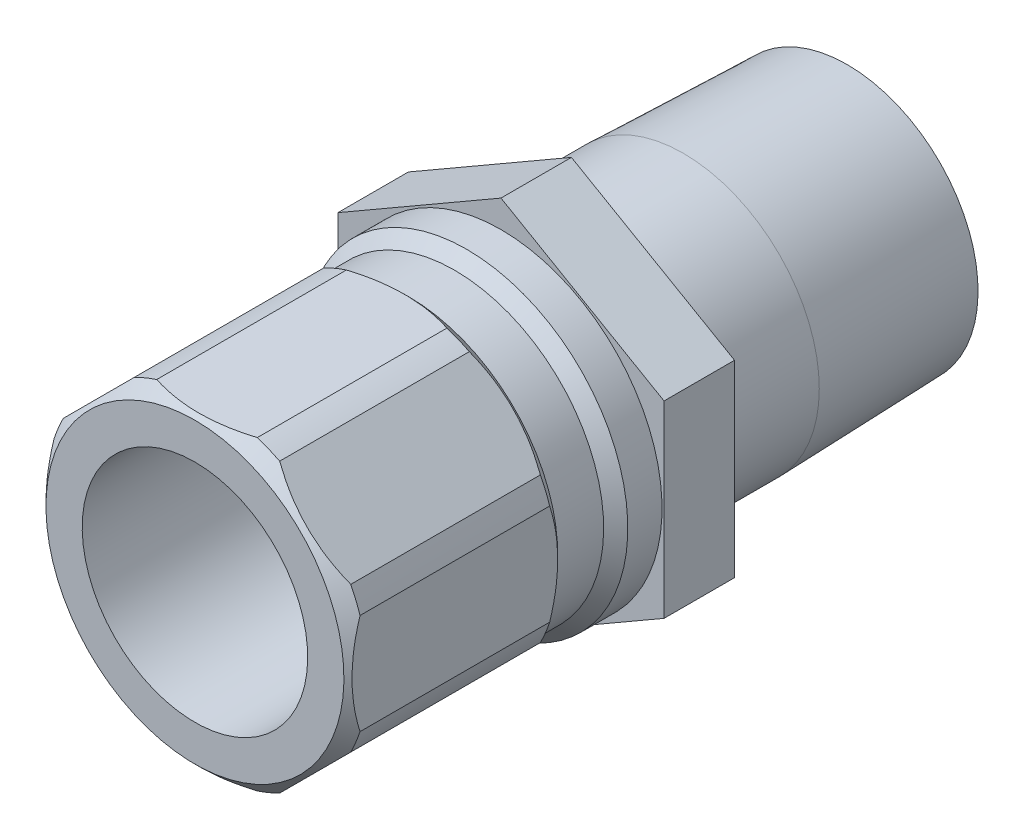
SolidWorks part; units mm, degrees
ref_plane "Front Plane" through (0, 0, 0) normal (0, 0, 1) x (1, 0, 0)
ref_plane "Top Plane" through (0, 0, 0) normal (0, 1, 0) x (1, 0, 0)
ref_plane "Right Plane" through (0, 0, 0) normal (1, 0, 0) x (0, 0, -1)
sketch "Sketch1" plane through (0, 0, 0) normal (1, 0, 0) x (0, 0, -1)
  line L0 (0, 0) -> (-22.479, 0) construction
  line L1 (-19.304, 7.112) -> (-19.304, 9.398)
  line L2 (-5.8166, 9.398) -> (-5.8166, 0) construction
  line L3 (-18.542, 10.16) -> (-6.5786, 10.16)
  line L4 (0, 8.5725) -> (0, 0) construction
  line L5 (-5.8166, 9.398) -> (-2.921, 9.398)
  line L6 (-2.159, 10.16) -> (0, 10.16)
  line L7 (0, 10.16) -> (0, 8.5725)
  line L8 (-5.8166, 9.398) -> (-6.5786, 10.16)
  line L9 (-2.921, 9.398) -> (-2.159, 10.16)
  line L10 (-19.304, 9.398) -> (-18.542, 10.16)
  line L11 (-1.0716, 6.2611) -> (21.844, 6.2611)
  line L12 (0, 8.5725) -> (11.5062, 8.5725)
  line L13 (11.5062, 8.5725) -> (21.844, 8.2494)
  line L14 (21.844, 8.2494) -> (21.844, 6.2611)
  line L15 (4.445, 0) -> (0, 0) construction
  line L16 (-19.304, 7.112) -> (-1.524, 7.112)
  line L17 (-1.524, 7.112) -> (-1.0716, 6.2611)
  dimension "D1" = 19.304
  dimension "D2" = 2.8956
  dimension "D3" = 0.762
  dimension "D4" = 45
  dimension "D5" = 13.4874
  dimension "D6" = 45
  dimension "D7" = 1.79
  dimension "D8" = 10.3378
  dimension "D9" = 41.148
  dimension "D10" = 3.175
  dimension "D11" = 4.445
  dimension "D12" = 12.5222
  dimension "D13" = 17.145
  dimension "D14" = 20.32
  dimension "D15" = 118
  dimension "D16" = 14.224
  dimension "D17" = 17.78
revolve "Revolve1" add sketch "Sketch1" angle 360 about L0
sketch "Sketch2" plane through (0, 0, 0) normal (0, 0, 1) x (1, 0, 0)
  line L1 (-10.287, 5.9392) -> (-10.287, -5.9392)
  line L2 (-10.287, -5.9392) -> (0, -11.8784)
  line L3 (0, -11.8784) -> (10.287, -5.9392)
  line L4 (10.287, -5.9392) -> (10.287, 5.9392)
  line L5 (10.287, 5.9392) -> (0, 11.8784)
  line L6 (0, 11.8784) -> (-10.287, 5.9392)
  circle A0 centre (0, 0) radius 10.287 construction
  circle A1 centre (0, 0) radius 6.2611 construction
  circle A2 centre (0, 0) radius 6.2611
  dimension "D1" = 20.574
extrude "Boss-Extrude1" add sketch "Sketch2" against normal up to vertex (4.445 mm away)
sketch "Sketch3" plane through (0, 0, 0) normal (0, 0, 1) x (1, 0, 0)
  line L1 (9.652, -3.998) -> (9.652, 3.998)
  line L2 (9.652, 3.998) -> (3.998, 9.652)
  line L3 (3.998, 9.652) -> (-3.998, 9.652)
  line L4 (-3.998, 9.652) -> (-9.652, 3.998)
  line L5 (-9.652, 3.998) -> (-9.652, -3.998)
  line L6 (-9.652, -3.998) -> (-3.998, -9.652)
  line L7 (-3.998, -9.652) -> (3.998, -9.652)
  line L8 (3.998, -9.652) -> (9.652, -3.998)
  circle A0 centre (0, 0) radius 9.652 construction
  dimension "D1" = 19.304
extrude "Cut-Extrude1" cut sketch "Sketch3" along normal through all from vertex at 5.8166 flip side to cut
